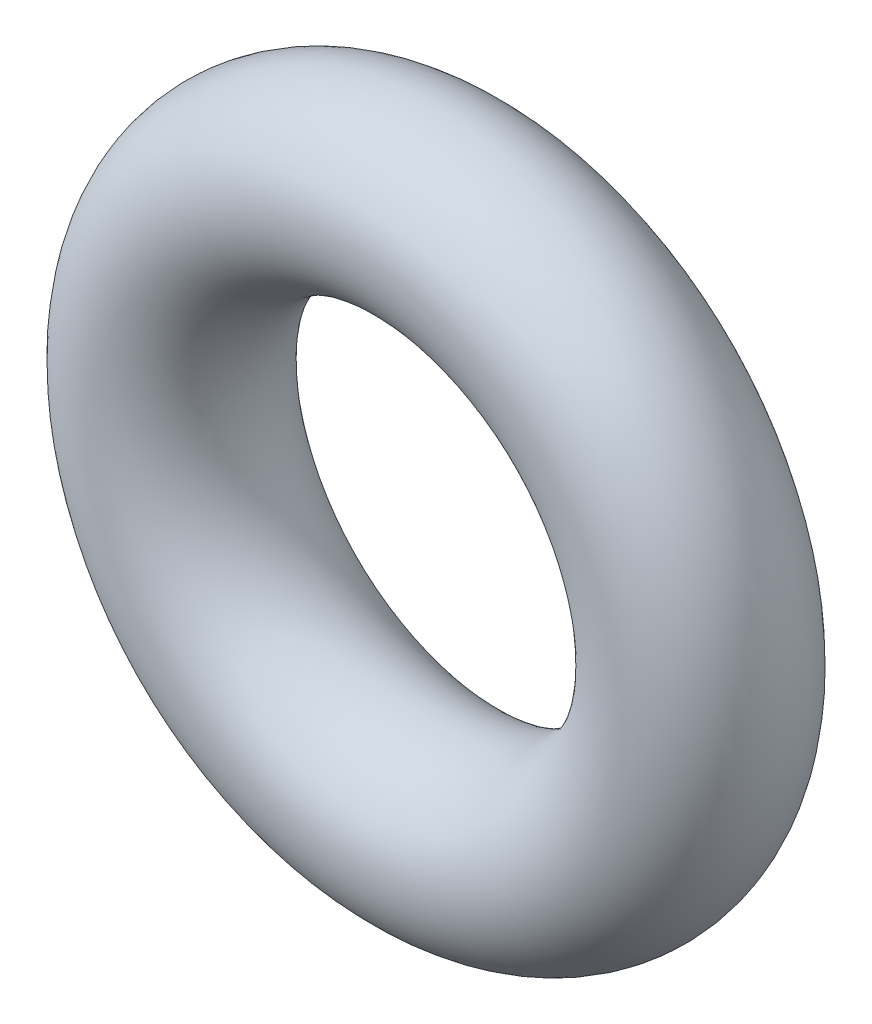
SolidWorks part; units mm, degrees
ref_plane "前视基准面" through (0, 0, 0) normal (0, 0, 1) x (1, 0, 0)
ref_plane "上视基准面" through (0, 0, 0) normal (0, 1, 0) x (1, 0, 0)
ref_plane "右视基准面" through (0, 0, 0) normal (1, 0, 0) x (0, 0, -1)
sketch "草图1" plane through (0, 0, 0) normal (0, 1, 0) x (1, 0, 0)
  line L0 (0, 89.2735) -> (0, -69.1029) construction
  line L1 (-97.3206, 0) -> (67.0324, 0) construction
  line L2 (-30, 81.4294) -> (-30, -63.5) construction
  circle A0 centre (-30, 0) radius 10
  point P7 (-30, 0)
  point P8 (-30, 0)
  dimension "D2" = 20
  dimension "D1" = 30
revolve "旋转1" add sketch "草图1" angle 360 about L0
